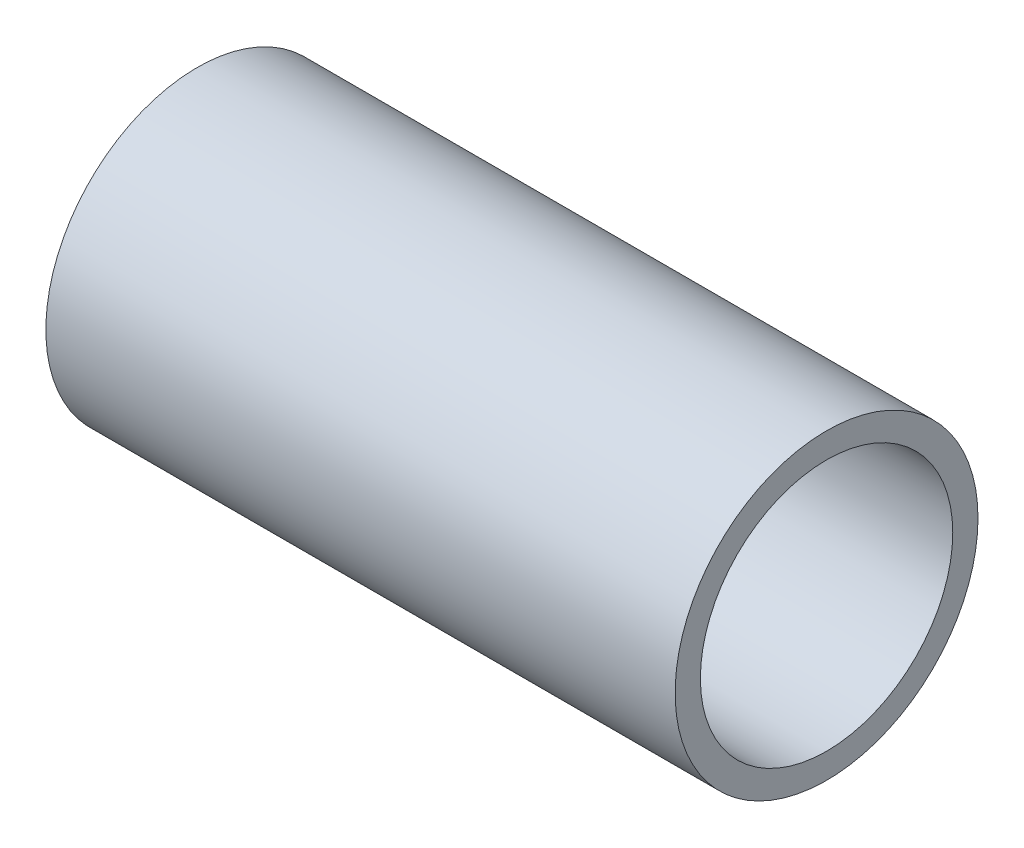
SolidWorks part; units mm, degrees
ref_plane "Ebene vorne" through (0, 0, 0) normal (0, 0, 1) x (1, 0, 0)
ref_plane "Ebene oben" through (0, 0, 0) normal (0, 1, 0) x (1, 0, 0)
ref_plane "Ebene rechts" through (0, 0, 0) normal (1, 0, 0) x (0, 0, -1)
sketch "Skizze1" plane through (0, 0, 0) normal (0, 0, 1) x (1, 0, 0)
  line L0 (0, 0) -> (-31030.4542, 0) construction
  line L1 (0, 0) -> (0, 27.5) construction
  line L2 (-62.3348, 25) -> (62.3348, 25)
  line L3 (-62.3348, 25) -> (-62.3348, 30)
  line L4 (-62.3348, 30) -> (62.3348, 30)
  line L5 (62.3348, 25) -> (62.3348, 30)
  line L6 (-62.3348, 25) -> (62.3348, 30) construction
  line L7 (-62.3348, 30) -> (62.3348, 25) construction
  point P3 (0, 27.5)
  dimension "D1" = 50
  dimension "D2" = 124.6696
  dimension "D3" = 5
revolve "Rotation1" add sketch "Skizze1" angle 360 about L0
